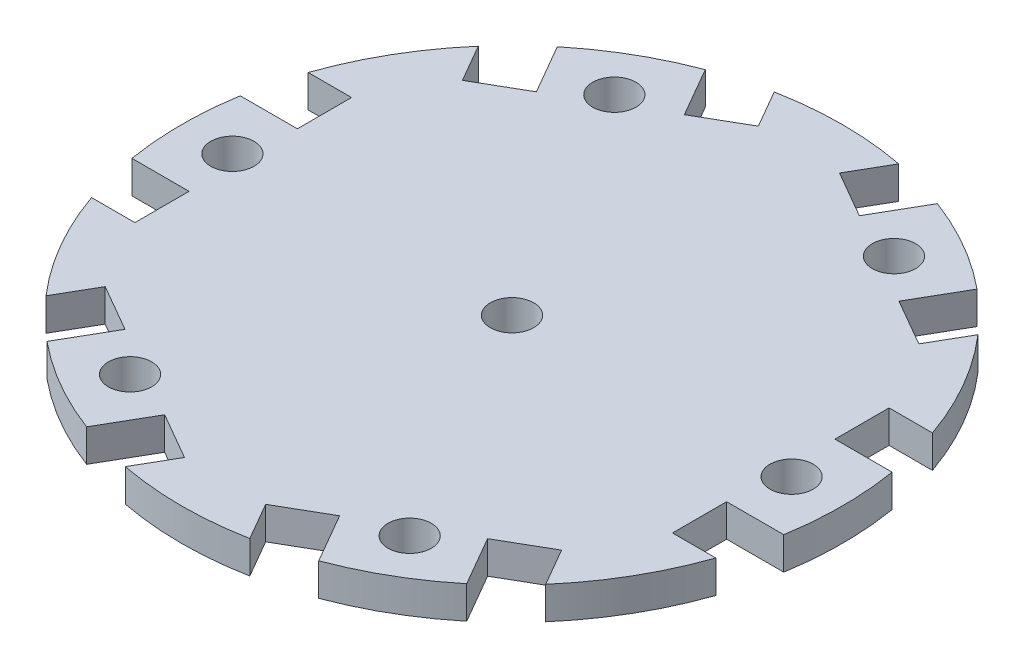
SolidWorks part; units mm, degrees
ref_plane "Alzado" through (0, 0, 0) normal (0, 0, 1) x (1, 0, 0)
ref_plane "Planta" through (0, 0, 0) normal (0, 1, 0) x (1, 0, 0)
ref_plane "Vista lateral" through (0, 0, 0) normal (1, 0, 0) x (0, 0, -1)
sketch "Croquis1" plane through (0, 0, 0) normal (0, 1, 0) x (1, 0, 0)
  circle A0 centre (0, 0) radius 30.5
extrude "Saliente-Extruir1" add sketch "Croquis1" along normal blind 3
sketch "Croquis2" plane through (0, 3, 0) normal (0, 1, 0) x (1, 0, 0)
  circle A0 centre (0, 0) radius 2
extrude "Cortar-Extruir1" cut sketch "Croquis2" against normal blind 4
sketch "Croquis5" plane through (0, 3, 0) normal (0, 1, 0) x (1, 0, 0)
  line L1 (28.8141, -5) -> (30.0874, -5)
  line L2 (28.8141, 5) -> (30.0874, 5)
  line L3 (-24.8141, 10) -> (-28.8141, 10)
  line L4 (24.8141, -5) -> (24.8141, -10)
  line L5 (-24.8141, -10) -> (-28.8141, -10)
  line L6 (24.8141, -5) -> (28.8141, -5)
  line L7 (24.8141, 5) -> (24.8141, 10)
  line L8 (-24.8141, 5) -> (-28.8141, 5)
  line L9 (-24.8141, 5) -> (-24.8141, 10)
  line L10 (-24.8141, -5) -> (-28.8141, -5)
  line L11 (-24.8141, -5) -> (-24.8141, -10)
  line L12 (24.8141, 5) -> (28.8141, 5)
  line L13 (24.8141, -10) -> (28.8141, -10)
  line L14 (24.8141, 10) -> (28.8141, 10)
  line L15 (-28.8141, 5) -> (-30.0874, 5)
  line L16 (-28.8141, -5) -> (-30.0874, -5)
  line L17 (18.7372, 22.4537) -> (19.3738, 23.5564)
  line L18 (-24.8141, 0) -> (-12.407, -21.4896)
  line L19 (-12.407, -21.4896) -> (12.407, -21.4896)
  line L20 (12.407, -21.4896) -> (24.8141, 0)
  line L21 (24.8141, 0) -> (12.407, 21.4896)
  line L22 (12.407, 21.4896) -> (-12.407, 21.4896)
  line L23 (-12.407, 21.4896) -> (-24.8141, 0)
  line L24 (-21.0673, -16.4896) -> (-23.0673, -19.9537)
  line L25 (-3.7468, -26.4896) -> (-5.7468, -29.9537)
  line L26 (-16.7372, -18.9896) -> (-18.7372, -22.4537)
  line L27 (-16.7372, -18.9896) -> (-21.0673, -16.4896)
  line L28 (-8.0769, -23.9896) -> (-10.0769, -27.4537)
  line L29 (-8.0769, -23.9896) -> (-3.7468, -26.4896)
  line L30 (-18.7372, -22.4537) -> (-19.3738, -23.5564)
  line L31 (-10.0769, -27.4537) -> (-10.7136, -28.5564)
  line L32 (10.0769, 27.4537) -> (10.7136, 28.5564)
  line L33 (16.7372, 18.9896) -> (21.0673, 16.4896)
  line L34 (16.7372, 18.9896) -> (18.7372, 22.4537)
  line L35 (8.0769, 23.9896) -> (3.7468, 26.4896)
  line L36 (8.0769, 23.9896) -> (10.0769, 27.4537)
  line L37 (21.0673, 16.4896) -> (23.0673, 19.9537)
  line L38 (3.7468, 26.4896) -> (5.7468, 29.9537)
  line L39 (-3.7468, 26.4896) -> (-5.7468, 29.9537)
  line L40 (-21.0673, 16.4896) -> (-23.0673, 19.9537)
  line L41 (-8.0769, 23.9896) -> (-10.0769, 27.4537)
  line L42 (-8.0769, 23.9896) -> (-3.7468, 26.4896)
  line L43 (-16.7372, 18.9896) -> (-18.7372, 22.4537)
  line L44 (-16.7372, 18.9896) -> (-21.0673, 16.4896)
  line L45 (-10.0769, 27.4537) -> (-10.7136, 28.5564)
  line L46 (-18.7372, 22.4537) -> (-19.3738, 23.5564)
  line L47 (10.0769, -27.4537) -> (10.7136, -28.5564)
  line L48 (18.7372, -22.4537) -> (19.3738, -23.5564)
  line L49 (8.0769, -23.9896) -> (3.7468, -26.4896)
  line L50 (8.0769, -23.9896) -> (10.0769, -27.4537)
  line L51 (16.7372, -18.9896) -> (21.0673, -16.4896)
  line L52 (16.7372, -18.9896) -> (18.7372, -22.4537)
  line L53 (3.7468, -26.4896) -> (5.7468, -29.9537)
  line L54 (21.0673, -16.4896) -> (23.0673, -19.9537)
  circle A0 centre (0, 0) radius 21.4896 construction
  circle A1 centre (0, 0) radius 30.5 construction
  arc A2 (-28.8141, 10) -> (-30.0874, 5) centre (0, 0) ccw
  arc A3 (-5.7468, 29.9537) -> (-10.7136, 28.5564) centre (0, 0) ccw
  arc A4 (-30.0874, -5) -> (-28.8141, -10) centre (0, 0) ccw
  arc A5 (30.0874, -5) -> (28.8141, -10) centre (0, 0) cw
  arc A6 (28.8141, 10) -> (30.0874, 5) centre (0, 0) cw
  arc A7 (-23.0673, -19.9537) -> (-19.3738, -23.5564) centre (0, 0) ccw
  arc A8 (-10.7136, -28.5564) -> (-5.7468, -29.9537) centre (0, 0) ccw
  arc A9 (-19.3738, 23.5564) -> (-23.0673, 19.9537) centre (0, 0) ccw
  arc A10 (19.3738, 23.5564) -> (23.0673, 19.9537) centre (0, 0) cw
  arc A11 (5.7468, 29.9537) -> (10.7136, 28.5564) centre (0, 0) cw
  arc A12 (10.7136, -28.5564) -> (5.7468, -29.9537) centre (0, 0) cw
  arc A13 (23.0673, -19.9537) -> (19.3738, -23.5564) centre (0, 0) cw
extrude "Cortar-Extruir3" cut sketch "Croquis5" against normal blind 4 contours L15 L8 L9 L3 M2 | L14 L7 L12 L2 M2 | L4 L13 L1 L6 M2 | L54 L51 L52 L48 M2 | L49 L53 L47 L50 M2 | L28 L31 L25 L29 M2 | L30 L26 L27 L24 M2 | L10 L16 L5 L11 M2 | L43 L46 L40 L44 M2 | L45 L41 L42 L39 M2 | L38 L35 L36 L32 M2 | L33 L37 L17 L34 M2
sketch "Croquis7" plane through (0, 3, 0) normal (0, 1, 0) x (1, 0, 0)
  line L2 (25.8141, 0) -> (12.907, 22.3556)
  line L3 (12.907, 22.3556) -> (-12.907, 22.3556)
  line L4 (-12.907, 22.3556) -> (-25.8141, 0)
  line L5 (-25.8141, 0) -> (-12.907, -22.3556)
  line L6 (-12.907, -22.3556) -> (12.907, -22.3556)
  line L7 (12.907, -22.3556) -> (25.8141, 0)
  circle A0 centre (25.8141, 0) radius 2
  circle A4 centre (-25.8141, 0) radius 2
  circle A5 centre (0, 0) radius 22.3556 construction
  circle A6 centre (12.907, 22.3556) radius 2
  circle A7 centre (-12.907, -22.3556) radius 2
  circle A8 centre (-12.907, 22.3556) radius 2
  circle A9 centre (12.907, -22.3556) radius 2
extrude "Cortar-Extruir4" cut sketch "Croquis7" against normal blind 10 contours A8 L4 L3 | A4 L4 L5 | A4 L5 L4 | A8 L3 L4 | L2 A6 L3 | L3 A6 L2 | L7 A0 L2 | L2 A0 L7 | A7 L5 L6 | A7 L6 L5 | L6 A9 L7 | L7 A9 L6
